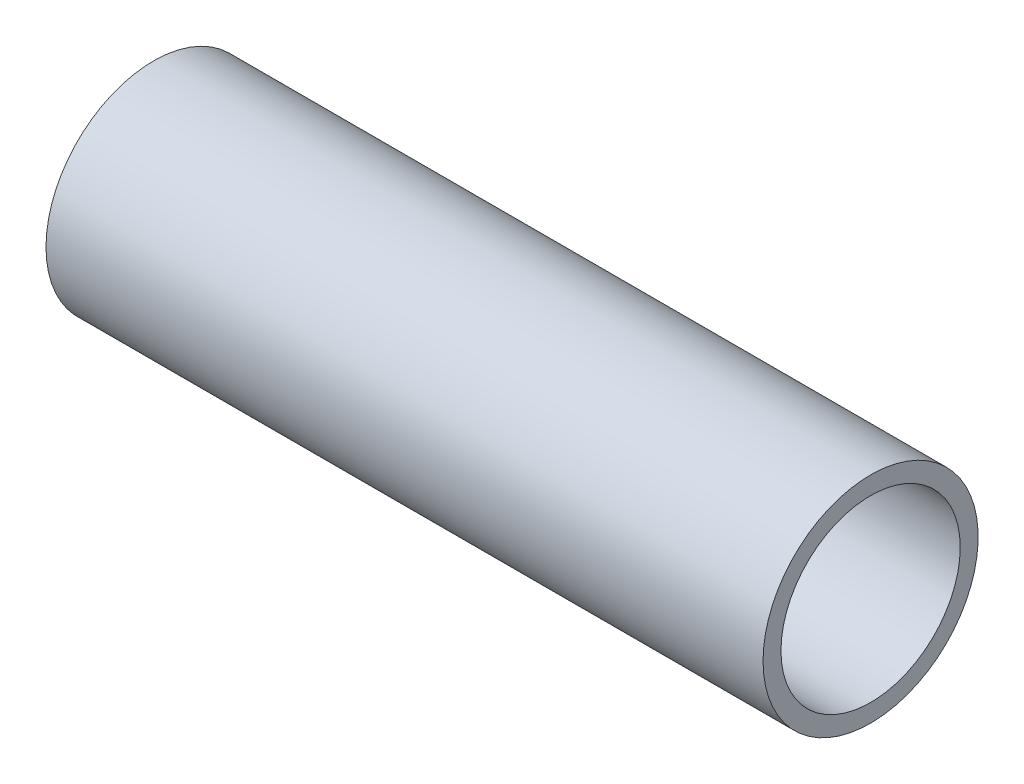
SolidWorks part; units mm, degrees
ref_plane "Ebene vorne" through (0, 0, 0) normal (0, 0, 1) x (1, 0, 0)
ref_plane "Ebene oben" through (0, 0, 0) normal (0, 1, 0) x (1, 0, 0)
ref_plane "Ebene rechts" through (0, 0, 0) normal (1, 0, 0) x (0, 0, -1)
sketch "Skizze1" plane through (0, 0, 0) normal (0, 0, 1) x (1, 0, 0)
  line L0 (0, 0) -> (82.6917, 0) construction
  line L2 (0, 30) -> (200, 30)
  line L3 (0, 30) -> (0, 25)
  line L4 (0, 25) -> (200, 25)
  line L5 (200, 30) -> (200, 25)
  dimension "D1" = 200
  dimension "D2" = 5
  dimension "D3" = 50
revolve "Rotation1" add sketch "Skizze1" angle 360 about L0
